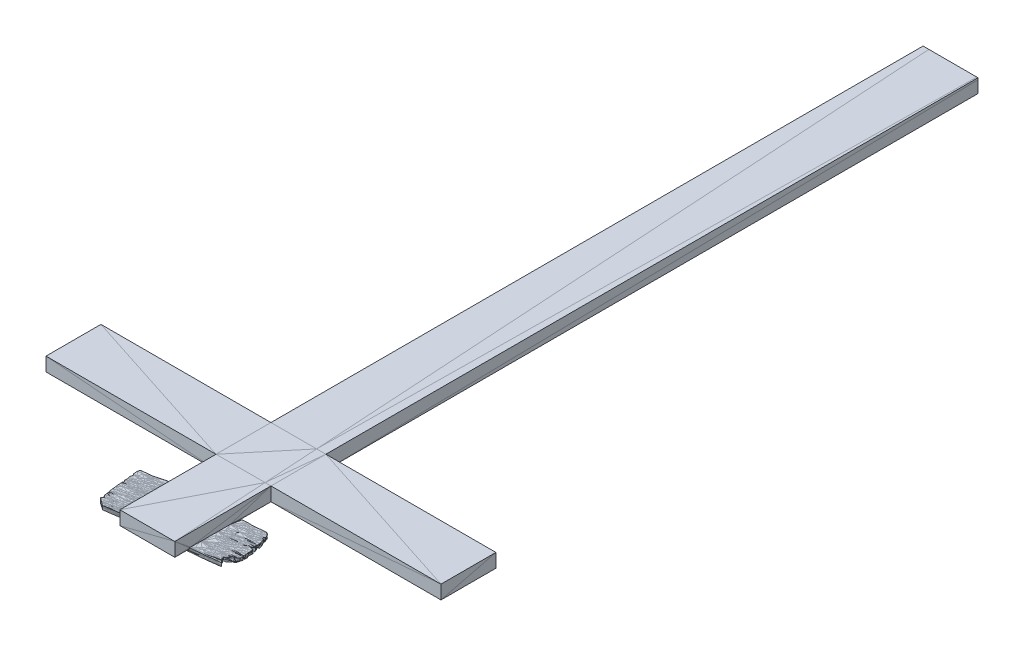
SolidWorks part; units mm, degrees
ref_plane "Front Plane" through (0, 0, 0) normal (1, 0, 0) x (0, 1, 0)
ref_plane "Top Plane" through (0, 0, 0) normal (0, 0, 1) x (0, 1, 0)
ref_plane "Right Plane" through (0, 0, 0) normal (0, 1, 0) x (-1, 0, 0)
imported_body "Imported1" [suppressed]
imported_body "Imported2"
imported_body "Imported3" [suppressed]
imported_body "Imported4" [suppressed]
ref_plane "Toes" through (0, 0, 2340) normal (0, 0, 1) x (0, 1, 0)
ref_plane "18in Span" through (0, 0, 1882.8) normal (0, 0, 1) x (0, 1, 0)
ref_plane "Ground" through (0, 0, 1248.054) normal (0, 0, 1) x (0, 1, 0)
sketch "Sketch1" plane through (0, 0, 1248.054) normal (0, 0, 1) x (0, 1, 0)
  line L0 (-176.7654, -181.1905) -> (-176.7654, 41.3095) construction
  line L1 (-469.1998, 295.9181) -> (57.8348, 295.9181)
  line L2 (-469.1998, 295.9181) -> (-469.1998, -360.7151)
  line L3 (-469.1998, -360.7151) -> (57.8348, -360.7151)
  line L4 (57.8348, 295.9181) -> (57.8348, -360.7151)
  line L8 (-121.1354, 41.3095) -> (-176.7654, 41.3095) construction
  line L10 (-121.1354, -181.1905) -> (-176.7654, -181.1905) construction
  line L11 (-176.7654, 41.3095) -> (-176.7654, -181.1905) construction
  line L12 (-176.7654, -181.1905) -> (-121.1354, -181.1905) construction
  line L13 (-121.1354, 41.3095) -> (-176.7654, 41.3095) construction
  line L14 (-121.1354, -181.1905) -> (-121.1354, 41.3095) construction
  line L15 (-121.1354, -181.1905) -> (-121.1354, 41.3095) construction
  point P16 (-121.1354, -69.9405)
  point P17 (-176.7654, -69.9405)
  point P18 (-148.9504, 41.3095)
  point P19 (-148.9504, -181.1905)
extrude "Cut-Extrude1" cut sketch "Sketch1" against normal through all
ref_plane "Midplane Front" through (69.9405, 0, 0) normal (1, 0, 0) x (0, 0, -1)
ref_plane "Midplane Side" through (0, -148.9504, 0) normal (0, 1, 0) x (1, 0, 0)
sketch "Sketch2" plane through (0, 0, 0) normal (0, 1, 0) x (-1, 0, 0)
  line L1 (-685.6704, 4001.0983) -> (-635.6704, 4001.0983)
  line L2 (-685.6704, 4001.0983) -> (-685.6704, 3951.0983)
  line L3 (-685.6704, 3951.0983) -> (-635.6704, 3951.0983)
  line L4 (-635.6704, 4001.0983) -> (-635.6704, 3951.0983)
  line L5 (482.5728, 4012.6984) -> (532.5728, 4012.6984)
  line L6 (482.5728, 4012.6984) -> (482.5728, 3962.6984)
  line L7 (482.5728, 3962.6984) -> (532.5728, 3962.6984)
  line L8 (532.5728, 4012.6984) -> (532.5728, 3962.6984)
  line L9 (-218.0412, 3256.6985) -> (64.2408, 3256.6985)
  line L10 (-218.0412, 3256.6985) -> (-218.0412, 3106.6985)
  line L11 (-218.0412, 3106.6985) -> (64.2408, 3106.6985)
  line L12 (64.2408, 3256.6985) -> (64.2408, 3106.6985)
  dimension "D1" = 50
  dimension "D2" = 50
  dimension "D3" = 50
  dimension "D4" = 50
  dimension "D5" = 150
